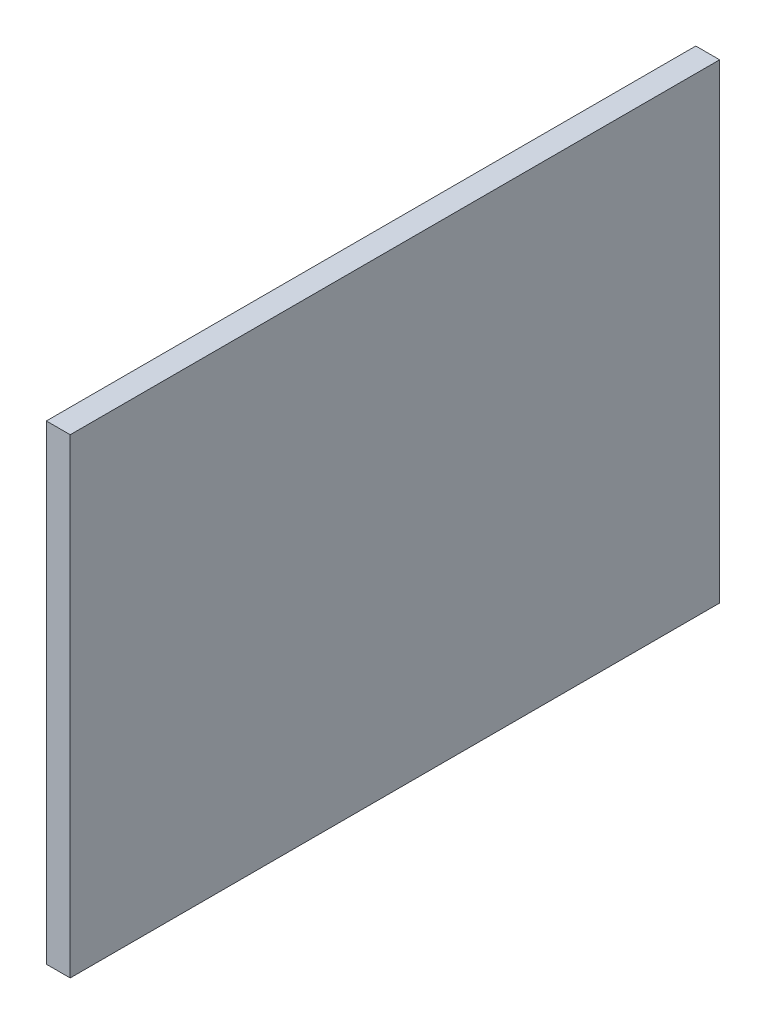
SolidWorks part; units mm, degrees
ref_plane "Plano frontal" through (0, 0, 0) normal (0, 0, 1) x (1, 0, 0)
ref_plane "Plano superior" through (0, 0, 0) normal (0, 1, 0) x (1, 0, 0)
ref_plane "Plano direito" through (0, 0, 0) normal (1, 0, 0) x (0, 0, -1)
sketch "Esboço2" plane through (0, 0, 0) normal (0, 0, 1) x (1, 0, 0)
  line L0 (263, -18) -> (263, 49982) construction
  line L1 (281, -18) -> (281, 49982) construction
  line L2 (-719, 1002.5) -> (49281, 1002.5) construction
  line L3 (-719.0211, 647.5) -> (49280.9789, 647.5) construction
  line L5 (263, 1002.6533) -> (281, 1002.6533)
  line L6 (263, 1002.6533) -> (263, 647.6533)
  line L7 (263, 647.6533) -> (280.9789, 647.6533)
  line L8 (281, 1002.6533) -> (280.9789, 647.6533)
  point P17 (281, 987)
  point P18 (281, 1002.6533)
  point P19 (263, 1002.6533)
extrude "Ressalto-extrusão1" add sketch "Esboço2" against normal blind 490
